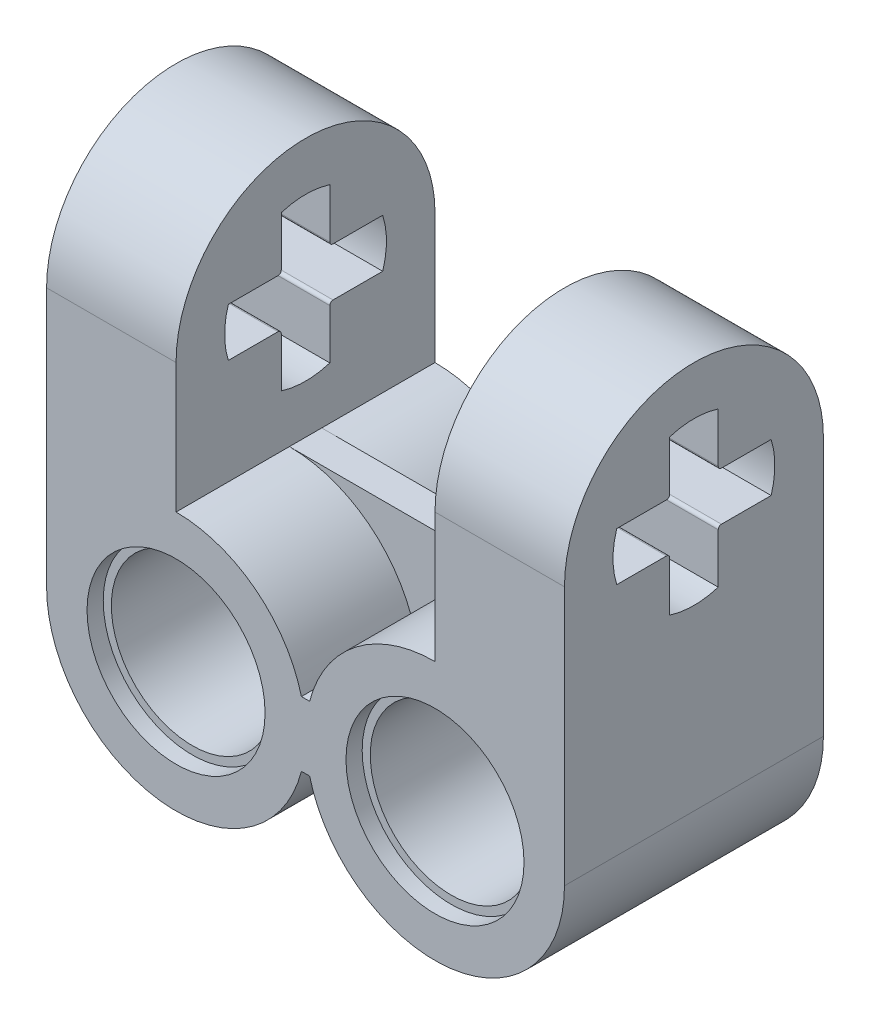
SolidWorks part; units mm, degrees
ref_plane "Alzado" through (0, 0, 0) normal (0, 0, 1) x (1, 0, 0)
ref_plane "Planta" through (0, 0, 0) normal (0, 1, 0) x (1, 0, 0)
ref_plane "Vista lateral" through (0, 0, 0) normal (1, 0, 0) x (0, 0, -1)
sketch "Croquis1" plane through (0, 0, 0) normal (0, 0, 1) x (1, 0, 0)
  line L0 (0, 34.8261) -> (0, -27.1749) construction
  line L1 (-4, 8) -> (4, 8)
  line L3 (4, 0) -> (-4, 0)
  arc A0 (4, 0) -> (4, 8) centre (4, 4) ccw
  arc A1 (-4, 0) -> (-4, 8) centre (-4, 4) cw
  point P3 (0, 8)
  point P11 (0, 0)
  dimension "D3" = 8
  dimension "D1" = 8
  dimension "D2" = 8
extrude "Extruir1" add sketch "Croquis1" along normal mid plane 8
sketch "Croquis4" plane through (0, 0, 0) normal (0, 0, 1) x (1, 0, 0)
  line L0 (-0.127, 5) -> (0.127, 5)
  line L1 (-8.749, 4) -> (8.2596, 4) construction
  line L2 (-4, 8) -> (4, 8)
  line L3 (-4, 0) -> (4, 0)
  line L4 (-0.127, 3) -> (0.127, 3)
  arc A0 (-0.127, 5) -> (-4, 8) centre (-4, 4) ccw
  arc A1 (4, 8) -> (0.127, 5) centre (4, 4) ccw
  arc A4 (-4, 8) -> (-4, 0) centre (-4, 4) ccw construction
  arc A5 (4, 0) -> (4, 8) centre (4, 4) ccw construction
  arc A6 (4, 0) -> (0.127, 3) centre (4, 4) cw
  arc A7 (-0.127, 3) -> (-4, 0) centre (-4, 4) cw
  dimension "D3" = 2
extrude "Cortar-Extruir4" cut sketch "Croquis4" against normal mid plane 8
sketch "Croquis5" plane through (0, 0, 0) normal (0, 0, 1) x (1, 0, 0)
  line L0 (-4, 8) -> (4, 8)
  line L1 (-0.127, 5) -> (0.127, 5)
  line L2 (-0.127, 5) -> (0.127, 5) construction
  arc A0 (-4, 8) -> (-0.127, 5) centre (-4, 4) cw
  arc A1 (4, 8) -> (0.127, 5) centre (4, 4) ccw
  arc A2 (0.127, 3) -> (0.127, 5) centre (4, 4) ccw construction
  arc A3 (-0.127, 5) -> (-0.127, 3) centre (-4, 4) ccw construction
extrude "Extruir2" add sketch "Croquis5" along normal mid plane 1
ref_plane "Plano1" through (0, 4, 0) normal (0, 1, 0) x (-1, 0, 0)
mirror "Simetría2" about plane through (0, 4, 0) normal (0, 1, 0) of "Extruir2"
ref_plane "Plano3" through (8, 0, 0) normal (1, 0, 0) x (0, 0, -1)
sketch "Croquis7" plane through (8, 0, 0) normal (1, 0, 0) x (0, 0, -1)
  line L0 (-4, 4) -> (-4, 12)
  line L1 (-4, 8) -> (-4, 0) construction
  line L2 (-4, 4) -> (4, 4)
  line L3 (4, 4) -> (4, 12)
  line L4 (4, 0) -> (4, 8) construction
  line L5 (0, 12) -> (0, 16) construction
  line L6 (0, 12) -> (4, 12) construction
  line L7 (0.75, 14.3848) -> (0.75, 12.85)
  line L8 (0.85, 12.75) -> (2.3848, 12.75)
  line L9 (-0.85, 12.75) -> (-2.3848, 12.75)
  line L10 (-0.75, 14.3848) -> (-0.75, 12.85)
  line L11 (-0.75, 9.6152) -> (-0.75, 11.15)
  line L12 (-0.85, 11.25) -> (-2.3848, 11.25)
  line L13 (0.85, 11.25) -> (2.3848, 11.25)
  line L14 (0.75, 9.6152) -> (0.75, 11.15)
  arc A0 (4, 12) -> (-4, 12) centre (0, 12) ccw
  arc A1 (-0.75, 14.3848) -> (0.75, 14.3848) centre (0, 12) cw
  arc A2 (2.3848, 12.75) -> (2.3848, 11.25) centre (0, 12) cw
  arc A3 (0.75, 12.85) -> (0.85, 12.75) centre (0.85, 12.85) ccw
  arc A4 (-0.75, 12.85) -> (-0.85, 12.75) centre (-0.85, 12.85) cw
  arc A5 (-2.3848, 12.75) -> (-2.3848, 11.25) centre (0, 12) ccw
  arc A6 (-0.75, 11.15) -> (-0.85, 11.25) centre (-0.85, 11.15) ccw
  arc A7 (0.75, 11.15) -> (0.85, 11.25) centre (0.85, 11.15) cw
  arc A8 (-0.75, 9.6152) -> (0.75, 9.6152) centre (0, 12) ccw
  dimension "D1" = 8
  dimension "D2" = 8
  dimension "D3" = 0.1
  dimension "D6" = 2.5
  dimension "D4" = 1.5
  dimension "D5" = 1.5
extrude "Extruir3" add sketch "Croquis7" against normal blind 4
mirror "Simetría3" about plane through (0, 0, 0) normal (1, 0, 0) of "Extruir3"
sketch "Croquis8" plane through (0, 0, 4) normal (0, 0, 1) x (1, 0, 0)
  circle A0 centre (-4, 4) radius 2.5
  arc A1 (-0.127, 5) -> (-4, 8) centre (-4, 4) ccw construction
  dimension "D1" = 5
extrude "Cortar-Extruir5" cut sketch "Croquis8" against normal through all
sketch "Croquis9" plane through (0, 0, 4) normal (0, 0, 1) x (1, 0, 0)
  circle A0 centre (-4, 4) radius 2.75
  circle A1 centre (-4, 4) radius 2.5 construction
  dimension "D1" = 5.5
extrude "Cortar-Extruir6" cut sketch "Croquis9" against normal blind 0.5
mirror "Simetría4" about plane through (0, 0, 0) normal (1, 0, 0) of "Cortar-Extruir6"
mirror "Simetría5" about plane through (0, 0, 0) normal (0, 0, 1) of "Simetría4", "Cortar-Extruir6"
mirror "Simetría6" about plane through (0, 0, 0) normal (1, 0, 0) of "Cortar-Extruir5"
